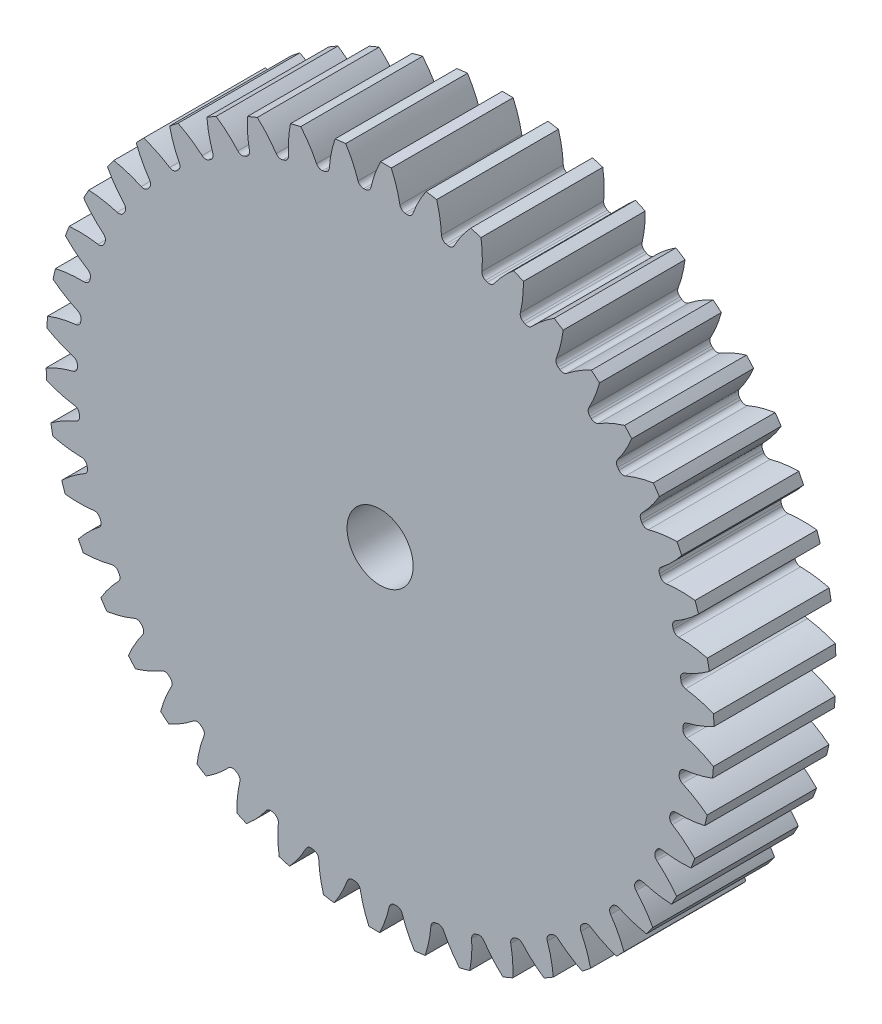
SolidWorks part; units mm, degrees
ref_plane "Front" through (0, 0, 0) normal (0, 0, 1) x (1, 0, 0)
ref_plane "Top" through (0, 0, 0) normal (0, 1, 0) x (1, 0, 0)
ref_plane "Right" through (0, 0, 0) normal (1, 0, 0) x (0, 0, -1)
sketch "Sketch3" plane through (0, 0, 0) normal (0, 0, 1) x (1, 0, 0)
  circle A0 centre (0, 0) radius 243.84
  dimension "od" = 487.68
extrude "gearBody" add sketch "Sketch3" along normal blind 88.9
sketch "Sketch2" plane through (0, 0, 0) normal (0, 0, 1) x (1, 0, 0)
  line L0 (0, 0) -> (202.8723, 84.0324) construction
  line L1 (243.3922, -17.0762) -> (0, 0) construction
  line L2 (0, 0) -> (36.3143, 0) construction
  line L3 (233.648, 3.869) -> (233.3704, -12.0248) construction
  line L5 (233.5092, -4.0779) -> (0, 0) construction
  line L7 (0, 0) -> (219.5874, 0) construction
  arc A0 (219.5873, -0.1931) -> (219.4601, -7.4743) centre (0, 0) ccw construction
  arc A1 (243.6922, 8.4874) -> (243.2473, -16.9911) centre (0, 0) ccw construction
  arc A2 (233.648, 3.869) -> (233.3704, -12.0248) centre (0, 0) ccw construction
  arc A3 (220.9323, -4.5908) -> (220.9579, -3.1262) centre (0, 0) ccw
  arc A4 (243.3922, -17.0762) -> (223.9064, -8.6457) centre (199.8144, -91.0648) ccw
  arc A5 (243.3922, -17.0762) -> (243.84, 8.5674) centre (0, 0) ccw
  arc A6 (243.84, 8.5674) -> (224.0717, 0.8224) centre (202.8723, 84.0324) cw
  arc A7 (220.9579, -3.1262) -> (224.0717, 0.8224) centre (225.0926, -3.1847) cw
  arc A8 (223.9064, -8.6457) -> (220.9323, -4.5908) centre (225.0665, -4.6767) cw
  point P6 (243.84, 8.5674)
  point P22 (243.3922, -17.0762)
  dimension "baseDia" = 439.1747
  dimension "od" = 487.68
  dimension "pd" = 467.36
  dimension "rd" = 441.96
  dimension "rFillet" = 4.1351
  dimension "pointX" = 243.84
  dimension "pointY" = 8.5674
  dimension "CTT" = 15.8937
  dimension "flankCenterAngle" = 22.5
extrude "toothCut" cut sketch "Sketch2" along normal through all
pattern_circular "CirPattern1" count 46 over 360 about axis through (0, 0, 0) along (0, 0, 1) of "toothCut"
sketch "hub1Dia" plane through (0, 0, 0) normal (0, 0, -1) x (-1, 0, 0)
  circle A0 centre (0, 0) radius 12.7
  dimension "hub1Dia" = 25.4
sketch "hub2Dia" plane through (0, 0, 88.9) normal (0, 0, 1) x (1, 0, 0)
  circle A0 centre (0, 0) radius 12.7
  dimension "hub2dia" = 25.4
sketch "boreDia" plane through (0, 0, 0) normal (0, 0, 1) x (1, 0, 0)
  circle A0 centre (0, 0) radius 24.13
  dimension "boreDia" = 48.26
extrude "bore" cut sketch "boreDia" against normal mid plane 25400
